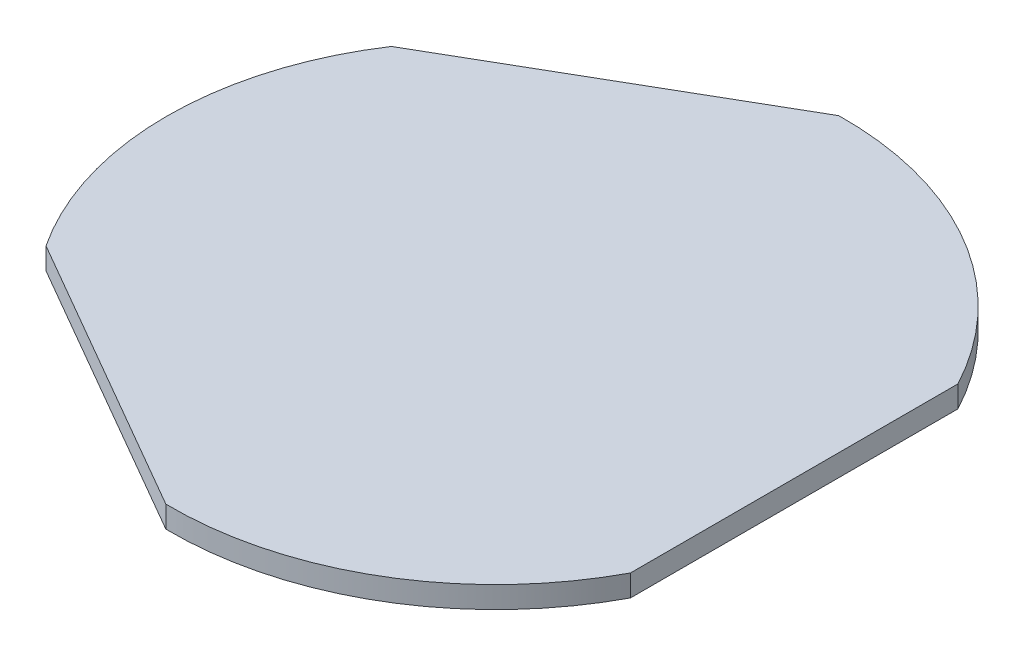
SolidWorks part; units mm, degrees
ref_plane "前视基准面" through (0, 0, 0) normal (0, 0, 1) x (1, 0, 0)
ref_plane "上视基准面" through (0, 0, 0) normal (0, 1, 0) x (1, 0, 0)
ref_plane "右视基准面" through (0, 0, 0) normal (1, 0, 0) x (0, 0, -1)
sketch "草图1" plane through (0, -17.3506, 0) normal (0, 1, 0) x (1, 0, 0)
  line L3 (-19.3143, 13.973) -> (-31.0923, 7.173)
  line L4 (-31.0923, -7.173) -> (-19.3143, -13.973)
  line L5 (-7.1912, -6.8) -> (-7.1912, 6.8)
  line L6 (-19.3143, 13.973) -> (-31.0923, 7.173)
  line L7 (-31.0923, -7.173) -> (-19.3143, -13.973)
  line L8 (-7.1912, -6.8) -> (-7.1912, 6.8)
  arc A3 (-7.1912, 6.8) -> (-19.3143, 13.973) centre (-19.1175, 0.4744) ccw
  arc A4 (-31.0923, 7.173) -> (-31.0923, -7.173) centre (-20.2503, 0) ccw
  arc A5 (-19.3143, -13.973) -> (-7.1912, -6.8) centre (-19.1175, -0.4744) ccw
  arc A6 (-7.1912, 6.8) -> (-19.3143, 13.973) centre (-19.1175, 0.4744) ccw
  arc A7 (-31.0923, 7.173) -> (-31.0923, -7.173) centre (-20.2503, 0) ccw
  arc A8 (-19.3143, -13.973) -> (-7.1912, -6.8) centre (-19.1175, -0.4744) ccw
  dimension "D1" = 0
extrude "凸台-拉伸1" add sketch "草图1" along normal up to surface (0.9 mm away)
